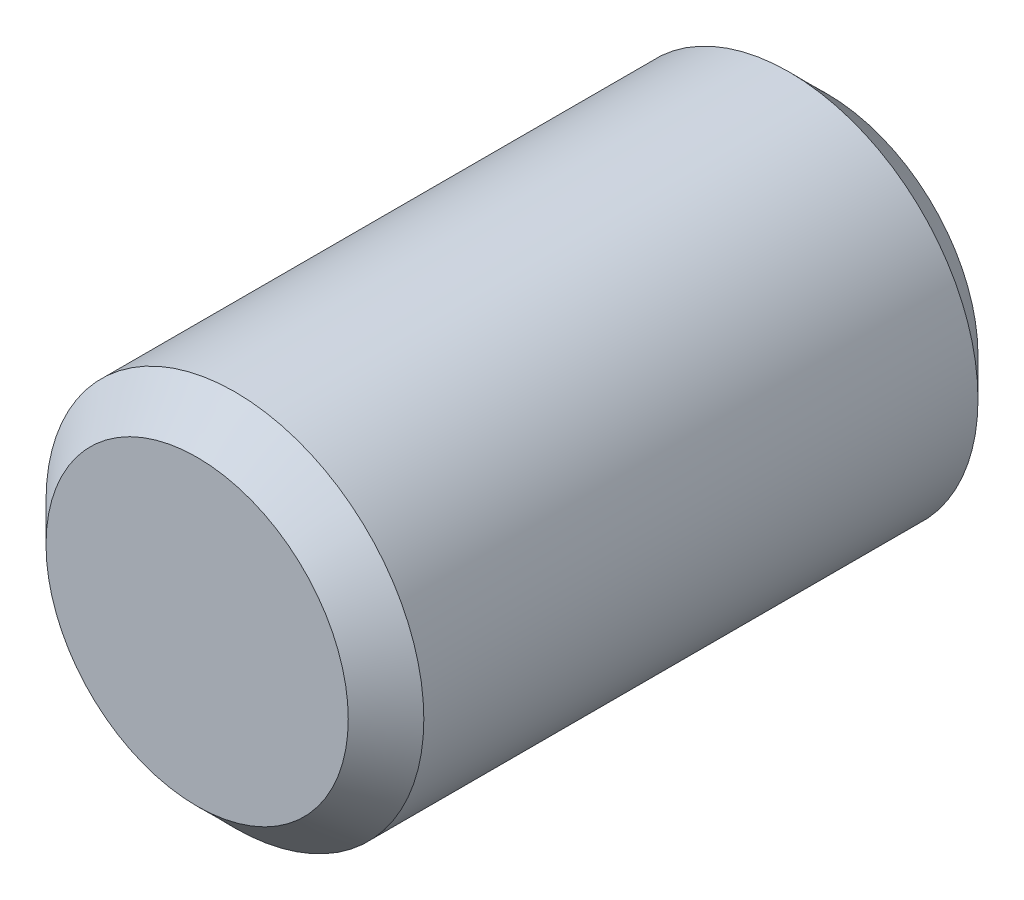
SolidWorks part; units mm, degrees
ref_plane "Plan de face" through (0, 0, 0) normal (0, 0, 1) x (1, 0, 0)
ref_plane "Plan de dessus" through (0, 0, 0) normal (0, 1, 0) x (1, 0, 0)
ref_plane "Plan de droite" through (0, 0, 0) normal (1, 0, 0) x (0, 0, -1)
sketch "Esquisse1" plane through (0, 0, 0) normal (0, 0, 1) x (1, 0, 0)
  circle A0 centre (0, 0) radius 1.5
  dimension "D1" = 3
extrude "Boss.-Extru.1" add sketch "Esquisse1" along normal blind 5
chamfer "Chanfrein1" distance 0.3 angle 45 2 edges at (1.5, 0, 0) (1.5, 0, 5)
sketch "Esquisse2" plane through (0, 0, 0) normal (0, 0, -1) x (-1, 0, 0)
  line L1 (1.1547, 0) -> (0.5774, 1)
  line L2 (0.5774, 1) -> (-0.5774, 1)
  line L3 (-0.5774, 1) -> (-1.1547, 0)
  line L4 (-1.1547, 0) -> (-0.5774, -1)
  line L5 (-0.5774, -1) -> (0.5774, -1)
  line L6 (0.5774, -1) -> (1.1547, 0)
  circle A0 centre (0, 0) radius 1 construction
  dimension "D1" = 2
extrude "Enlèv. mat.-Extru.1" cut sketch "Esquisse2" against normal blind 2
